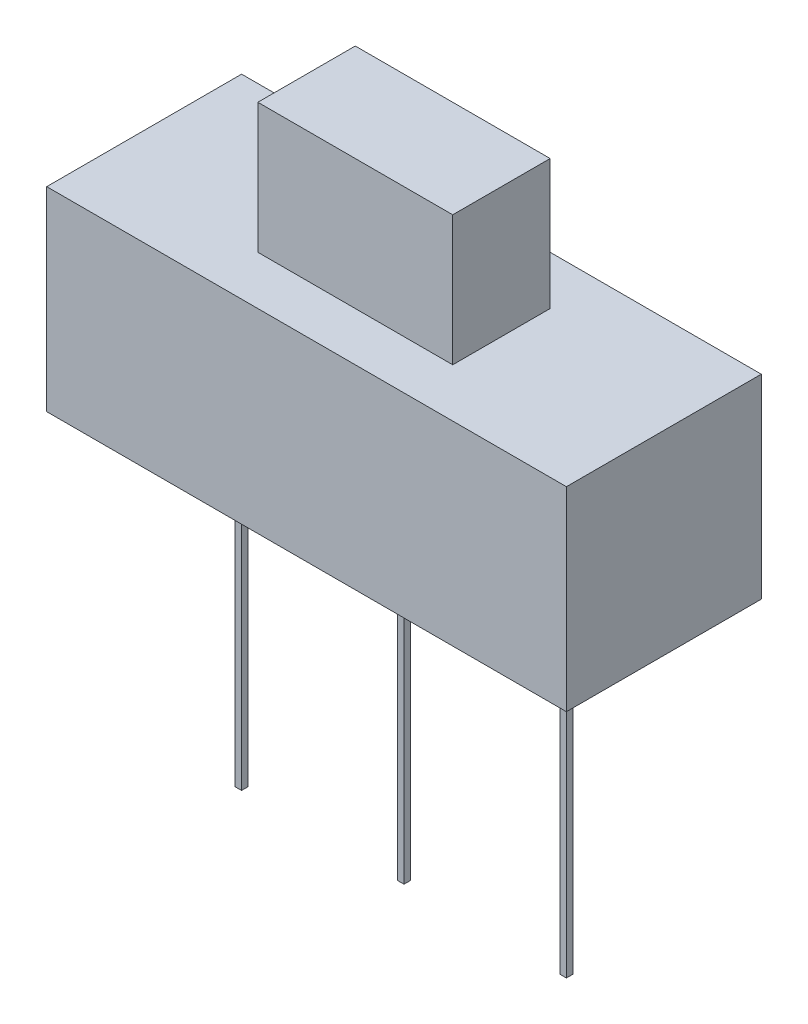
SolidWorks part; units mm, degrees
ref_plane "Front Plane" through (0, 0, 0) normal (0, 0, 1) x (1, 0, 0)
ref_plane "Top Plane" through (0, 0, 0) normal (0, 1, 0) x (1, 0, 0)
ref_plane "Right Plane" through (0, 0, 0) normal (1, 0, 0) x (0, 0, -1)
sketch "Sketch1" plane through (0, 0, 0) normal (0, 1, 0) x (1, 0, 0)
  line L1 (-4, -1.5) -> (4, -1.5)
  line L2 (-4, -1.5) -> (-4, 1.5)
  line L3 (-4, 1.5) -> (4, 1.5)
  line L4 (4, -1.5) -> (4, 1.5)
  line L5 (-4, -1.5) -> (4, 1.5) construction
  line L6 (-4, 1.5) -> (4, -1.5) construction
  point P0 (0, 0)
  dimension "D1" = 8
  dimension "D2" = 3
extrude "Boss-Extrude1" add sketch "Sketch1" along normal blind 3
sketch "Sketch2" plane through (0, 3, 0) normal (0, 1, 0) x (1, 0, 0)
  line L1 (-1.5, -0.75) -> (1.5, -0.75)
  line L2 (-1.5, -0.75) -> (-1.5, 0.75)
  line L3 (-1.5, 0.75) -> (1.5, 0.75)
  line L4 (1.5, -0.75) -> (1.5, 0.75)
  line L5 (-1.5, -0.75) -> (1.5, 0.75) construction
  line L6 (-1.5, 0.75) -> (1.5, -0.75) construction
  point P0 (0, 0)
  dimension "D1" = 3
  dimension "D2" = 1.5
extrude "Boss-Extrude2" add sketch "Sketch2" along normal blind 2
sketch "Sketch3" plane through (0, 0, 0) normal (0, -1, 0) x (1, 0, 0)
  line L0 (2.45, -0.05) -> (2.45, 0.05)
  line L1 (-0.05, -0.05) -> (0.05, -0.05)
  line L2 (-0.05, -0.05) -> (-0.05, 0.05)
  line L3 (-0.05, 0.05) -> (0.05, 0.05)
  line L4 (0.05, -0.05) -> (0.05, 0.05)
  line L5 (-0.05, -0.05) -> (0.05, 0.05) construction
  line L6 (-0.05, 0.05) -> (0.05, -0.05) construction
  line L7 (2.45, -0.05) -> (2.55, -0.05)
  line L8 (2.55, -0.05) -> (2.55, 0.05)
  line L9 (2.45, 0.05) -> (2.55, 0.05)
  line L10 (-0.05, -0.05) -> (-0.05, 0.05)
  line L11 (-0.05, -0.05) -> (0.05, -0.05)
  line L12 (0.05, -0.05) -> (0.05, 0.05)
  line L13 (-0.05, 0.05) -> (0.05, 0.05)
  line L14 (-2.55, -0.05) -> (-2.55, 0.05)
  line L15 (-2.55, -0.05) -> (-2.45, -0.05)
  line L16 (-2.45, -0.05) -> (-2.45, 0.05)
  line L17 (-2.55, 0.05) -> (-2.45, 0.05)
  point P0 (0, 0)
  dimension "D1" = 0.1
  dimension "D2" = 0.1
  dimension "D3" = 2
  dimension "D4" = 2
extrude "Boss-Extrude3" add sketch "Sketch3" along normal blind 5 contours L9 L0 L7 L8 | L1 L4 L3 L2 | L17 L14 L15 L16
